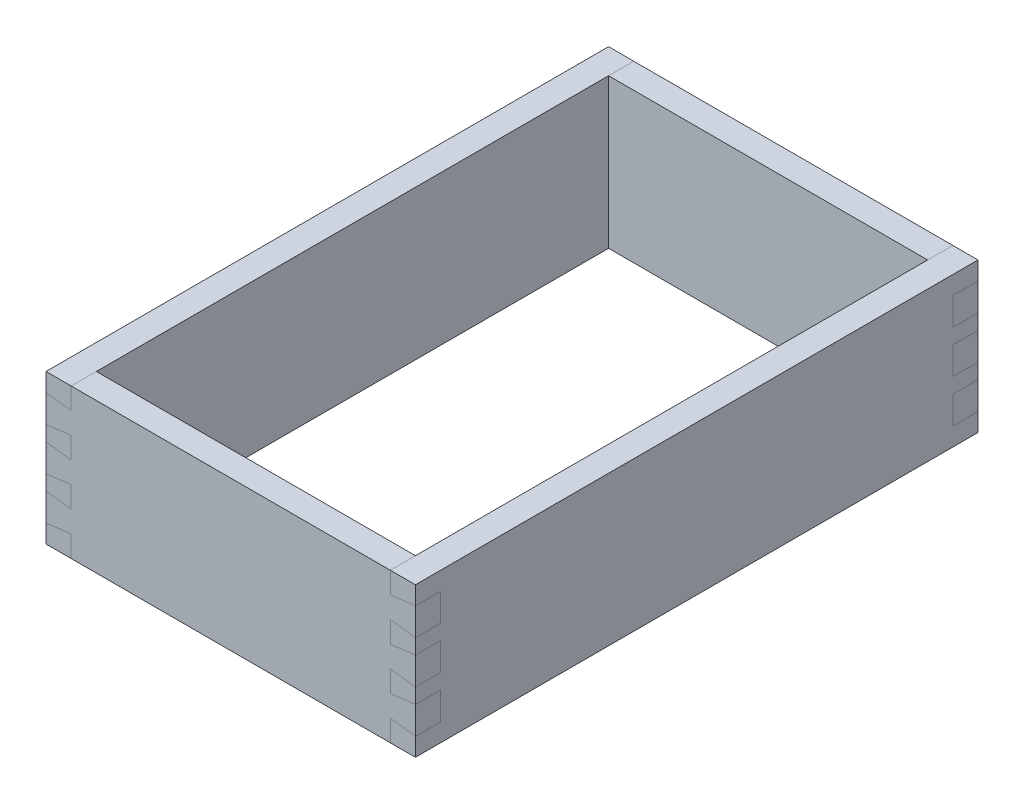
SolidWorks part; units mm, degrees
ref_plane "Front Plane" through (0, 0, 0) normal (0, 0, 1) x (1, 0, 0)
ref_plane "Top Plane" through (0, 0, 0) normal (0, 1, 0) x (1, 0, 0)
ref_plane "Right Plane" through (0, 0, 0) normal (1, 0, 0) x (0, 0, -1)
sketch "Sketch1" plane through (0, 0, 0) normal (0, 0, 1) x (1, 0, 0)
  line L1 (0, 0) -> (-110, 0)
  line L2 (0, 0) -> (0, 89)
  line L3 (0, 89) -> (-110, 89)
  line L4 (-110, 0) -> (-110, 89)
extrude "Boss-Extrude1" add sketch "Sketch1" along normal blind 15
sketch "Sketch2" plane through (0, 0, 15) normal (0, 0, 1) x (1, 0, 0)
  line L0 (-110, 89) -> (-95, 89)
  line L1 (0, 89) -> (-110, 89) construction
  line L2 (-95, 89) -> (-95, 76.2857)
  line L3 (-95, 76.2857) -> (-110, 78.1607)
  line L4 (-110, 89) -> (-110, 0) construction
  line L5 (-110, 78.1607) -> (-110, 89)
  line L6 (-95, 63.5714) -> (-110, 61.6964)
  line L7 (-110, 61.6964) -> (-110, 52.7321)
  line L8 (-110, 52.7321) -> (-95, 50.8571)
  line L9 (-95, 76.2857) -> (-103, 76.2857) construction
  line L10 (-103, 77.2857) -> (-103, 76.2857) construction
  line L11 (-95, 63.5714) -> (-103, 63.5714) construction
  line L12 (-103, 63.5714) -> (-103, 62.5714) construction
  line L13 (-95, 63.5714) -> (-95, 50.8571)
  line L14 (-110, 36.2679) -> (-95, 38.1429)
  line L15 (-95, 38.1429) -> (-95, 25.4286)
  line L16 (-95, 25.4286) -> (-110, 27.3036)
  line L17 (-110, 27.3036) -> (-110, 36.2679)
  line L18 (-95, 0) -> (-95, 12.7143)
  line L19 (-110, 0) -> (0, 0) construction
  line L20 (-95, 12.7143) -> (-110, 10.8393)
extrude "Cut-Extrude1" cut sketch "Sketch2" against normal blind 15 contours L18 L20 M18 M19 | L16 L15 L14 M18 | L13 L6 L8 M18 | L3 L2 M17 M18
sketch "Sketch3" plane through (0, 0, 15) normal (0, 0, 1) x (1, 0, 0)
  line L0 (0, 89) -> (-95, 89) construction
  line L1 (-95, 89) -> (-110, 89)
  line L2 (-95, 89) -> (-95, 0)
  line L3 (-95, 0) -> (-110, 0)
  line L4 (-110, 89) -> (-110, 0)
  line L5 (-110, 78.1607) -> (-110, 61.6964) construction
  line L6 (-95, 0) -> (0, 0) construction
extrude "Boss-Extrude5" add sketch "Sketch3" against normal blind 167.5 separate body
other "Intersect1"
combine bodies "Combine1" operation type add bodies to combine 111 107 108 110
mirror "Mirror1" about plane through (0, 0, -152.5) normal (0, 0, -1)
mirror "Mirror2" about plane through (0, 0, -320) normal (-1, 0, 0)
combine bodies "Combine2" operation type add bodies to combine 118 116
combine bodies "Combine3" operation type add bodies to combine 109 113
combine bodies "Combine4" operation type add bodies to combine 112 117
combine bodies "Combine5" operation type add bodies to combine 115 114
equation "\"Box Height\"= 89mm"
equation "\"Box Length\"= 220mm"
equation "\"Box Depth\"= 335mm"
equation "\"Material Thickness\" = 15mm"
equation "\"Dovetail Slope\"= 8mm"
equation "\"D1@Sketch1\"=\"Box Height\""
equation "\"D2@Sketch1\"=\"Box Length\"/2"
equation "\"D1@Boss-Extrude1\"=\"Material Thickness\""
equation "\"D1@Sketch2\"=\"Material Thickness\""
equation "\"D2@Sketch2\"=\"Box Height\"/7"
equation "\"D4@Sketch2\"=\"Dovetail Slope\""
equation "\"D5@Sketch2\"=\"D2@Sketch2\""
equation "\"D6@Sketch2\"=\"D4@Sketch2\""
equation "\"D7@Sketch2\"=\"D3@Sketch2\""
equation "\"D8@Sketch2\"=\"D5@Sketch2\""
equation "\"D9@Sketch2\"=\"D8@Sketch2\""
equation "\"D10@Sketch2\"=\"D9@Sketch2\""
equation "\"D11@Sketch2\"=\"D10@Sketch2\""
equation "\"D1@Cut-Extrude1\"=\"Material Thickness\""
equation "\"D1@Sketch3\"=\"Material Thickness\""
equation "\"D1@Boss-Extrude5\"=\"Box Depth\"/2"
